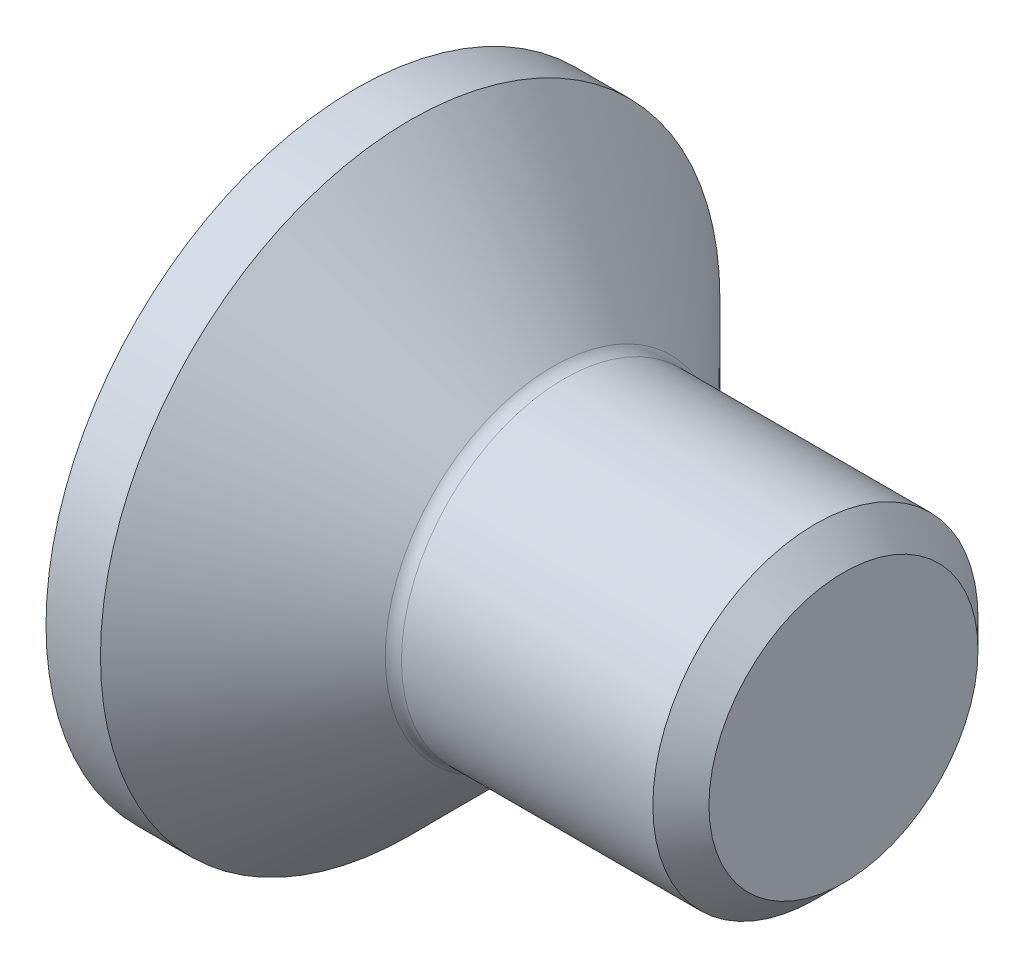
SolidWorks part; units mm, degrees
ref_plane "Plane1" through (0, 0, 0) normal (0, 0, 1) x (1, 0, 0)
ref_plane "Plane2" through (0, 0, 0) normal (0, 1, 0) x (1, 0, 0)
ref_plane "Plane3" through (0, 0, 0) normal (1, 0, 0) x (0, 0, -1)
sketch "BodySke" plane through (0, 0, 0) normal (0, 0, 1) x (1, 0, 0)
  line L0 (0, 0) -> (0, 7.62)
  line L1 (1.34, 7.62) -> (4.96, 4)
  line L2 (0, 7.62) -> (1.34, 7.62)
  line L3 (4.96, 4) -> (11.3095, 4)
  line L4 (12, 3.3095) -> (12, 0)
  line L5 (12, 0) -> (0, 0)
  line L6 (0, 0) -> (127, 0) construction
  line L7 (1.34, -7.62) -> (4.96, -4) construction
  line L8 (12, 3.3095) -> (11.3095, 4)
  line L9 (0, -7.62) -> (1.34, -7.62) construction
  line L10 (12, -3.3095) -> (11.3095, -4) construction
  line L11 (6.21, 10.35) -> (6.21, -11.875) construction
  line L12 (0, 19.05) -> (0, -3.175) construction
  dimension "D1" = 1.34
  dimension "Diameter" = 8
  dimension "Head_ht" = 4.96
  dimension "Length" = 12
  dimension "Body_ch_ang" = 45
  dimension "Head_dia" = 15.24
  dimension "Minor_dia" = 6.619
  dimension "Head_ang" = 90
  dimension "Advance" = 1.25
  dimension "Thread_nom" = 12
revolve "BaseBody" add sketch "BodySke"
fillet "Fillet1" radius 0.4 1 edges at (4.96, 0, 4)
sketch "Sketch2" plane through (0, 0, 0) normal (0, 0, 1) x (1, 0, 0)
  line L0 (0, 2.5) -> (3, 2.5)
  line L1 (3, 2.5) -> (4.4434, 0)
  line L2 (0, 0) -> (127, 0) construction
  line L3 (4.4434, 0) -> (0, 0)
  line L4 (0, 0) -> (0, 2.5)
  line L5 (0, -2.5) -> (3, -2.5) construction
  line L6 (0, 0) -> (47.625, 0) construction
  line L8 (0, 7.62) -> (0, -7.62) construction
  dimension "D2" = 60
  dimension "PreBroach_depth" = 3
  dimension "PreBroach_dia" = 5
revolve "PreBroach" cut sketch "Sketch2" angle 360 about L6
sketch "Sketch3" plane through (0, 0, 0) normal (-1, 0, 0) x (0, 0, 1)
  line L0 (-2.5, -1.4434) -> (-2.5, 1.4434)
  line L1 (-2.5, 1.4434) -> (0, 2.8868)
  line L2 (0, 2.8868) -> (2.5, 1.4434)
  line L3 (2.5, 1.4434) -> (2.5, -1.4434)
  line L4 (2.5, -1.4434) -> (0, -2.8868)
  line L5 (0, -2.8868) -> (-2.5, -1.4434)
  dimension "D1" = 2.5
  dimension "D2" = 2.5
  dimension "D3" = 5
  dimension "Hex_size" = 5
extrude "Hex" cut sketch "Sketch3" against normal blind 3
sketch "ThdSchSke" plane through (0, 0, 0) normal (0, 0, 1) x (1, 0, 0)
  line L0 (8.71, -3.3095) -> (8.2265, -4)
  line L1 (8.71, -3.3095) -> (9.1935, -4)
  line L2 (9.1935, -4) -> (9.1935, -5)
  line L3 (-3.175, 0) -> (5.1513, 0) construction
  line L4 (0, 7.62) -> (0, -7.62) construction
  line L5 (9.1935, -5) -> (8.2265, -5)
  line L6 (8.2265, -5) -> (8.2265, -4)
  dimension "Thread_minor" = 6.619
  dimension "Diameter" = 8
  dimension "Start" = 8.71
  dimension "SideAngle" = 55
  dimension "VeeAngle" = 70
  dimension "Overcut" = 10
revolve "ThreadSchematic" [suppressed] cut sketch "ThdSchSke" angle 360 about L3
pattern_linear "ThdSchPat" [suppressed]
equation "\"Thread_minor@ThreadCosmetic\"  =  \"Minor_dia@BodySke\""
equation "\"D1@Sketch3\" = \"Hex_size@Sketch3\" / 2"
equation "\"D2@Sketch3\" = \"D1@Sketch3\""
equation "\"D3@Sketch3\" = \"Hex_size@Sketch3\""
equation "\"Thread_length@ThreadCosmetic\" = ((sgn( (\"Length@BodySke\" - \"Advance@BodySke\" * 3.0 - \"Head_ht@BodySke\" ) - \"Thread_nom@BodySke\" )-1)*( (\"Length@BodySke\" - \"Advance@BodySke\" * 3.0 - \"Head_ht@BodySke\" "
equation "\"Thread_minor@ThdSchSke\" = \"Minor_dia@BodySke\""
equation "\"Diameter@ThdSchSke\" = \"Diameter@BodySke\""
equation "\"Overcut@ThdSchSke\" = \"Diameter@BodySke\" * 1.25"
equation "\"Start@ThdSchSke\" = 0.000001 + \"Length@BodySke\" - \"Thread_length@ThreadCosmetic\"  '---Countersunk---"
equation "\"Num_threads@ThdSchPat\" = int( \"Thread_length@ThreadCosmetic\" / \"Advance@BodySke\" + 0.999 )  + 1"
equation "\"Advance@ThdSchPat\" = \"Thread_length@ThreadCosmetic\" /  (\"Num_threads@ThdSchPat\" - 1) 'relax it"
equation "\"Num_threads@ThdSchPat\" = \"Num_threads@ThdSchPat\" - sgn( \"Num_threads@ThdSchPat\" - 1) '---chamfered tips only---"
